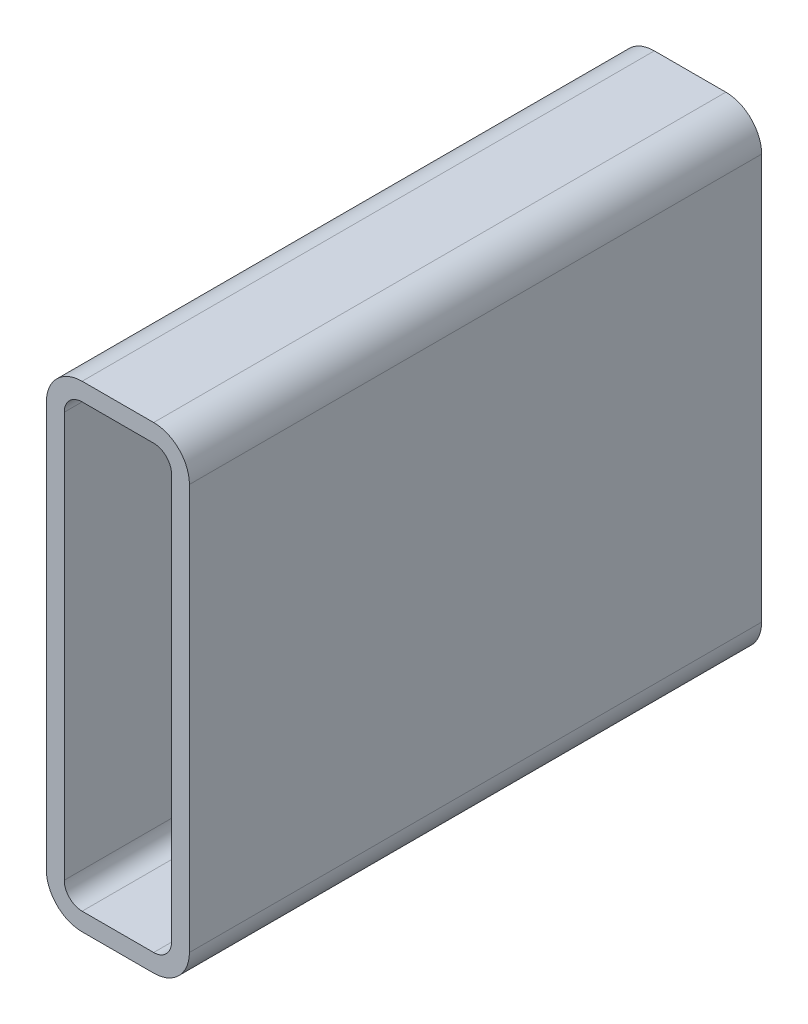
SolidWorks part; units mm, degrees
ref_plane "Front Plane" through (0, 0, 0) normal (0, 0, 1) x (1, 0, 0)
ref_plane "Top Plane" through (0, 0, 0) normal (0, 1, 0) x (1, 0, 0)
ref_plane "Right Plane" through (0, 0, 0) normal (1, 0, 0) x (0, 0, -1)
sketch "Sketch1" plane through (0, 0, 0) normal (0, 0, 1) x (1, 0, 0)
sketch_block_instance "HSS10x3x0.375-1"
sketch_block "HSS10x3x0.375"
extrude "Boss-Extrude1" add sketch "Sketch1" along normal blind 304.8
